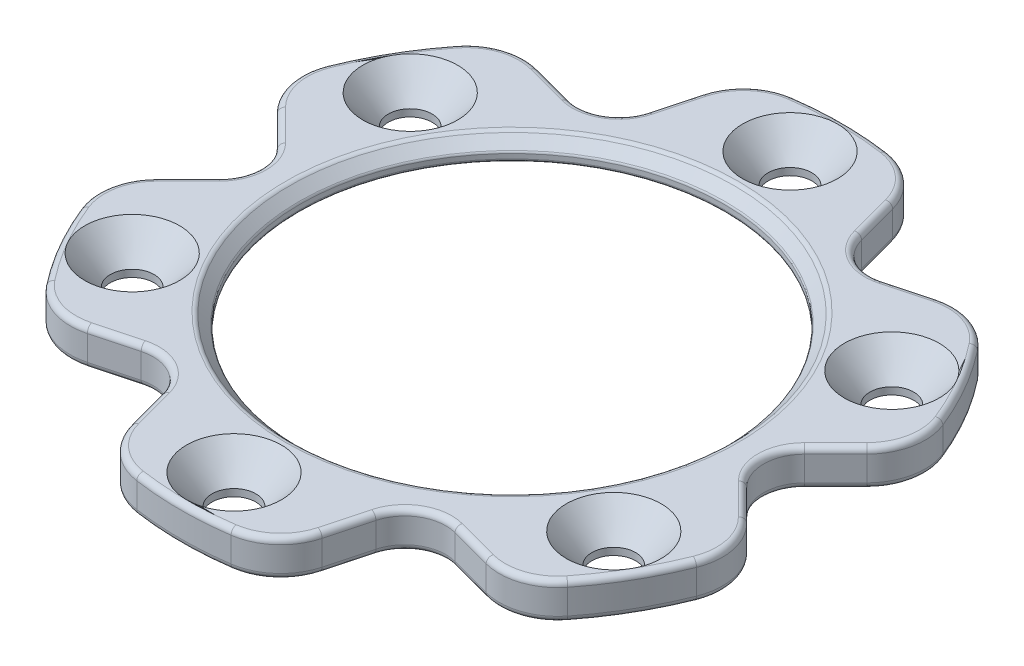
SolidWorks part; units mm, degrees
ref_plane "Front Plane" through (0, 0, 0) normal (0, 0, 1) x (1, 0, 0)
ref_plane "Top Plane" through (0, 0, 0) normal (0, 1, 0) x (1, 0, 0)
ref_plane "Right Plane" through (0, 0, 0) normal (1, 0, 0) x (0, 0, -1)
sketch "Sketch1" plane through (0, 0, 0) normal (0, 1, 0) x (1, 0, 0)
  line L1 (0, 0) -> (0, 63.7304) construction
  line L5 (0, 0) -> (103.6291, 0) construction
  circle A0 centre (0, 0) radius 18.415
  arc A3 (23.4639, 16.6402) -> (16.6402, 23.4639) centre (0, 0) ccw
  arc A5 (-23.4639, 16.6402) -> (16.6402, -23.4639) centre (0, 0) ccw
  arc A7 (16.6402, 23.4639) -> (-23.4639, 16.6402) centre (0, 0) ccw
  arc A8 (16.6402, -23.4639) -> (23.4639, 16.6402) centre (0, 0) ccw
  dimension "D2" = 36.83
  dimension "D3" = 57.531
extrude "Boss-Extrude1" add sketch "Sketch1" along normal blind 3.175
hole_wizard "CSK for #6 Flat Head Socket Cap Screw1" positions "Sketch2" profile "Sketch3" countersink size "#6" standard "ANSI Inch"
sketch "Sketch2" plane through (0, 3.175, 0) normal (0, 1, 0) x (1, 0, 0)
  point P0 (20.8972, 12.065)
  point P3 (-20.8972, -12.065)
  point P6 (0, 24.13)
  point P15 (-20.8972, 12.065)
  point P19 (0, -24.13)
  point P22 (20.8972, -12.065)
sketch "Sketch3" plane through (20.8972, 3.175, -12.065) normal (1, 0, 0) x (0, 0, 1)
  line L0 (0, 0) -> (0, 3.175)
  line L1 (0, 3.175) -> (1.8986, 3.175)
  line L2 (1.8986, 3.175) -> (1.8986, 2.555)
  line L3 (1.8986, 2.555) -> (4.1197, 0)
  line L5 (4.1197, 0) -> (0, 0)
  line L6 (-1.8987, 2.555) -> (-4.1197, 0) construction
  line L11 (0, -6.35) -> (0, 107.95) construction
  dimension "Thru Hole Dia." = 3.7973
  dimension "Thru Hole Depth" = 3.175
  dimension "Near C'Sink Dia." = 8.2394
  dimension "Near C'Sink Angle" = 82
chamfer "Chamfer1" distance 1.016 angle 45 1 edges at (0, 3.175, 18.415)
sketch "Sketch4" plane through (0, 0, 0) normal (0, -1, 0) x (1, 0, 0)
  circle A0 centre (0, 0) radius 20.6375
  circle A1 centre (0, 0) radius 18.415 construction
  dimension "D1" = 41.275
  dimension "D2" = 2.2225
extrude "Cut-Extrude1" cut sketch "Sketch4" against normal blind 1.397 and the other way through all
sketch "Sketch6" plane through (0, 3.175, 0) normal (0, 1, 0) x (1, 0, 0)
  line L0 (38.4056, 18.0345) -> (38.1194, -17.7484)
  line L3 (3.5844, 42.2774) -> (34.4302, 24.1382)
  line L4 (0, 0) -> (0, 23.622) construction
  line L5 (22.8855, 2.5145) -> (38.4056, 18.0345)
  line L8 (22.8855, -2.5145) -> (38.1194, -17.7484)
  line L11 (25.4, 0) -> (47.1304, 0) construction
  line L14 (34.8211, -24.2429) -> (3.6892, -41.8866)
  line L17 (12.7, 21.997) -> (23.5652, 40.8161) construction
  line L18 (9.2652, 21.0767) -> (3.5844, 42.2774)
  line L19 (13.6204, 18.5622) -> (34.4302, 24.1382)
  line L20 (13.6204, -18.5622) -> (34.8211, -24.2429)
  line L23 (9.2652, -21.0767) -> (3.6892, -41.8866)
  line L26 (12.7, -21.997) -> (23.5652, -40.8161) construction
  line L27 (-3.5844, -42.2774) -> (-34.4302, -24.1382)
  line L28 (-9.2652, -21.0767) -> (-3.5844, -42.2774)
  line L29 (-13.6204, -18.5622) -> (-34.4302, -24.1382)
  line L30 (-12.7, -21.997) -> (-23.5652, -40.8161) construction
  line L31 (-38.4056, -18.0345) -> (-38.1194, 17.7484)
  line L32 (-22.8855, -2.5145) -> (-38.4056, -18.0345)
  line L33 (-22.8855, 2.5145) -> (-38.1194, 17.7484)
  line L34 (-25.4, 0) -> (-47.1304, 0) construction
  line L35 (-34.8211, 24.2429) -> (-3.6892, 41.8866)
  line L36 (-13.6204, 18.5622) -> (-34.8211, 24.2429)
  line L37 (-9.2652, 21.0767) -> (-3.6892, 41.8866)
  line L38 (-12.7, 21.997) -> (-23.5652, 40.8161) construction
  arc A10 (9.2652, 21.0767) -> (13.6204, 18.5622) centre (12.7, 21.997) ccw
  arc A17 (22.8855, 2.5145) -> (22.8855, -2.5145) centre (25.4, 0) ccw
  arc A18 (13.6204, -18.5622) -> (9.2652, -21.0767) centre (12.7, -21.997) ccw
  arc A19 (-9.2652, -21.0767) -> (-13.6204, -18.5622) centre (-12.7, -21.997) ccw
  arc A20 (-22.8855, -2.5145) -> (-22.8855, 2.5145) centre (-25.4, 0) ccw
  arc A21 (-13.6204, 18.5622) -> (-9.2652, 21.0767) centre (-12.7, 21.997) ccw
  point P34 (0, 0)
  dimension "D1" = 90
  dimension "D2" = 3.556
  dimension "D3" = 30
  dimension "D4" = 6
extrude "Cut-Extrude2" cut sketch "Sketch6" against normal through all
fillet "Fillet9" radius 5.08 12 edges at (20.3225, 1.5875, -20.358) (7.4693, 1.5875, -27.7788) (-7.4693, 1.5875, -27.7788) (-20.3225, 1.5875, 20.358) (-7.4693, 1.5875, 27.7788) (27.7918, 1.5875, 7.4208) (27.7918, 1.5875, -7.4208) (7.4693, 1.5875, 27.7788) (20.3225, 1.5875, 20.358) (-27.7918, 1.5875, 7.4208) (-27.7918, 1.5875, -7.4208) (-20.3225, 1.5875, -20.358)
fillet "Fillet6" radius 0.254 4 edges at (0, 0, 20.6375) (0, 1.397, -20.6375) (0, 1.397, -18.415) (0, 2.159, 18.415)
fillet "Fillet7" radius 0.508 73 edges at (0, 3.175, 19.431) (24.9117, 0, -14.3828) (26.9655, 0, -7.7815) (21.844, 0, 0) (26.9655, 0, 7.7815) (24.9117, 0, 14.3827) (0, 0, 28.7655) (-6.7438, 0, 27.2436) (-10.922, 0, 18.9175) (-20.2218, 0, 19.4621) (-24.9117, 0, 14.3828) (-6.7438, 0, -27.2436) (0, 0, -28.7655) (6.7438, 0, -27.2436) (10.922, 0, -18.9175) (20.2218, 0, -19.4621) (24.9117, 3.175, -14.3828) (26.9655, 3.175, -7.7815) (21.844, 3.175, 0) (26.9655, 3.175, 7.7815) (0, 3.175, 28.7655) (24.9117, 3.175, 14.3827) (-6.7438, 3.175, 27.2436) (-10.922, 3.175, 18.9175) (-20.2218, 3.175, 19.4621) (-24.9117, 3.175, 14.3828) (-6.7438, 3.175, -27.2436) (0, 3.175, -28.7655) (6.7438, 3.175, -27.2436) (10.922, 3.175, -18.9175) (20.2218, 3.175, -19.4621) (24.2334, 0, 3.8623) (24.2334, 0, -3.8623) (-15.4616, 0, -19.0556) (-10.922, 0, -18.9175) (-8.7718, 0, -22.9179) (8.7718, 0, -22.9179) (15.4616, 0, -19.0556) (24.2334, 3.175, 3.8623) (24.2334, 3.175, -3.8623) (-15.4616, 3.175, -19.0556) (-10.922, 3.175, -18.9175) (-8.7718, 3.175, -22.9179) (8.7718, 3.175, -22.9179) (15.4616, 3.175, -19.0556) (20.2218, 0, 19.4621) (15.4616, 0, 19.0556) (10.922, 0, 18.9175) (8.7718, 0, 22.9179) (6.7438, 0, 27.2436) (-8.7718, 0, 22.9179) (-15.4616, 0, 19.0556) (-26.9655, 0, 7.7815) (-24.2334, 0, 3.8623) (-21.844, 0, 0) (-24.2334, 0, -3.8623) (-26.9655, 0, -7.7815) (-24.9117, 0, -14.3827) (-20.2218, 0, -19.4621) (20.2218, 3.175, 19.4621) (15.4616, 3.175, 19.0556) (10.922, 3.175, 18.9175) (8.7718, 3.175, 22.9179) (6.7438, 3.175, 27.2436) (-8.7718, 3.175, 22.9179) (-15.4616, 3.175, 19.0556) (-26.9655, 3.175, 7.7815) (-24.2334, 3.175, 3.8623) (-21.844, 3.175, 0) (-24.2334, 3.175, -3.8623) (-26.9655, 3.175, -7.7815) (-24.9117, 3.175, -14.3827) (-20.2218, 3.175, -19.4621)
sketch "Sketch5" [suppressed] plane through (0, 0, 0) normal (1, 0, 0) x (0, 0, -1)
  line L0 (-18.415, 0.6096) -> (-17.907, 0.6096) construction
  line L1 (-18.415, 1.2192) -> (-17.907, 1.2192)
  line L2 (-18.415, 0) -> (-17.907, 0)
  line L3 (-25.008, 0) -> (25.008, 0) construction
  line L4 (-24.246, 1.2192) -> (24.246, 1.2192) construction
  line L5 (0, 0) -> (0, -13.7841) construction
  arc A0 (-18.415, 1.2192) -> (-18.415, 0) centre (-18.415, 0.6096) ccw
  arc A1 (-17.907, 0) -> (-17.907, 1.2192) centre (-17.907, 0.6096) ccw
  point P2 (-18.161, 0.6096)
  dimension "D1" = 0.508
  dimension "D2" = 36.83
extrude "Boss-Extrude2" [suppressed] add sketch "Sketch5" along normal blind 0.508 separate body
sketch "Sketch7" plane through (0, 0, 0) normal (1, 0, 0) x (0, 0, -1)
  line L0 (0, 0) -> (0, 7.7079) construction
  line L1 (-20.3835, 1.397) -> (20.3835, 1.397) construction
  line L2 (-19.8755, 0.6985) -> (-19.1643, 0.6985) construction
  line L3 (-19.8755, 1.397) -> (-19.1643, 1.397)
  line L4 (-19.8755, 0) -> (-19.1643, 0)
  line L5 (-20.8915, 0) -> (20.8915, 0) construction
  line L6 (-20.574, 0.508) -> (-20.574, 2.149) construction
  circle A0 centre (-19.685, 0.508) radius 0.889 construction
  arc A1 (-19.8755, 1.397) -> (-19.8755, 0) centre (-19.8755, 0.6985) ccw
  arc A2 (-19.1643, 0) -> (-19.1643, 1.397) centre (-19.1643, 0.6985) ccw
  point P2 (-20.574, 0.508)
  point P3 (-19.685, 1.397)
  point P11 (-19.5199, 0.6985)
  dimension "D2" = 1.778
  dimension "D1" = 41.148
  dimension "D3" = 0.7112
extrude "Boss-Extrude3" [suppressed] add sketch "Sketch7" against normal blind 0.254 separate body
